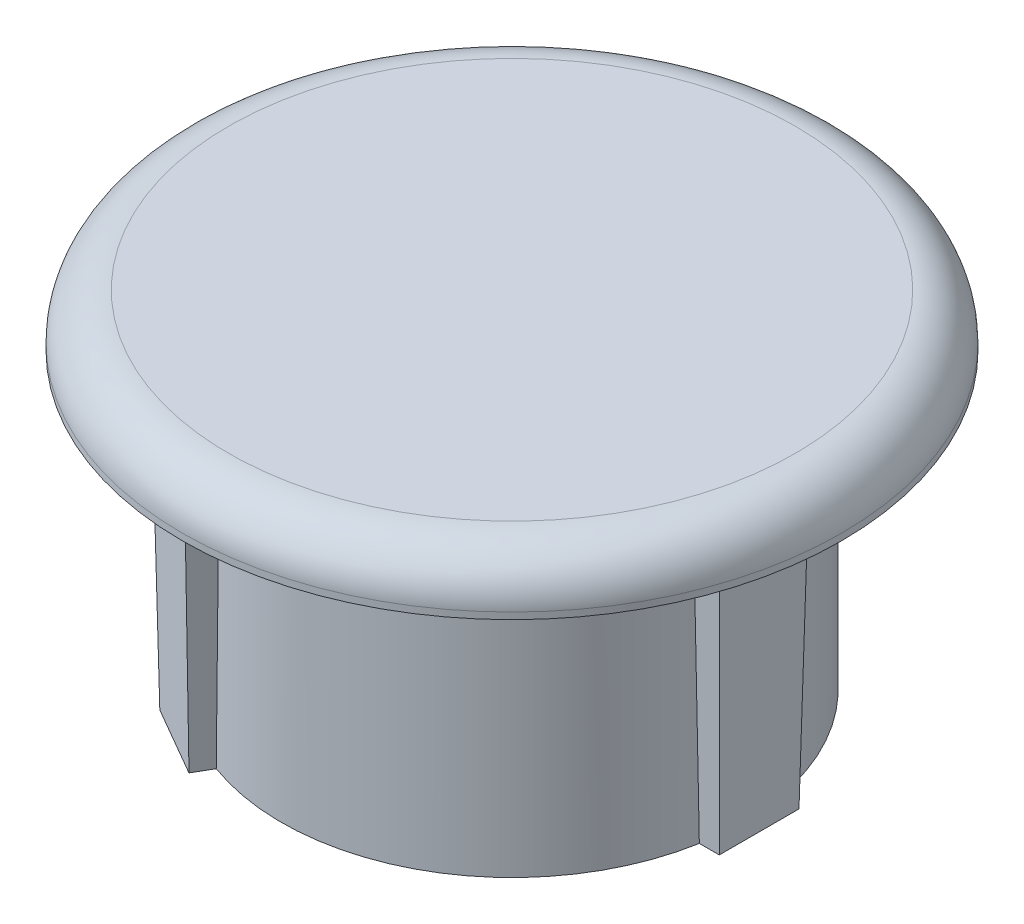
SolidWorks part; units mm, degrees
ref_plane "Face" through (0, 0, 0) normal (0, 0, 1) x (1, 0, 0)
ref_plane "Dessus" through (0, 0, 0) normal (0, 1, 0) x (1, 0, 0)
ref_plane "Droite" through (0, 0, 0) normal (1, 0, 0) x (0, 0, -1)
sketch "Esquisse1" plane through (0, 0, 0) normal (0, 0, 1) x (1, 0, 0)
  line L0 (0, 0) -> (0, 39.604) construction
  line L1 (2.3, 4) -> (0, 4)
  line L2 (2.3, 0) -> (3.5, 0)
  line L3 (2.3, 0) -> (2.3, 4)
  line L5 (3.5, 0) -> (3.5, 4.45)
  line L6 (0, 4) -> (0, 5.25)
  line L7 (0, 5.25) -> (4.3, 5.25)
  line L8 (5, 4.55) -> (5, 4.45)
  line L9 (5, 4.45) -> (3.5, 4.45)
  arc A0 (4.3, 5.25) -> (5, 4.55) centre (4.3, 4.55) cw
  point P13 (5, 5.25)
  dimension "D7" = 0.7
  dimension "D1" = 1.2
  dimension "D2" = 7
  dimension "D3" = 0.8
  dimension "D4" = 4
  dimension "D5" = 5.25
  dimension "D6" = 10
revolve "Révolution1" add sketch "Esquisse1" angle 360 about L0
sketch "Esquisse2" plane through (0, 0, 0) normal (0, -1, 0) x (1, 0, 0)
  line L0 (0, 0) -> (5.8892, 0) construction
  line L1 (3.4473, 0.6048) -> (3.75, 0.6048)
  line L2 (-1.1999, -3.2879) -> (-1.3512, -3.55)
  line L3 (3.4473, -0.6048) -> (3.75, -0.6048)
  line L4 (3.75, 0.6048) -> (3.75, -0.6048)
  line L5 (-2.2474, -2.6831) -> (-2.3988, -2.9452)
  line L6 (-1.3512, -3.55) -> (-2.3988, -2.9452)
  line L7 (-2.2474, 2.6831) -> (-2.3988, 2.9452)
  line L8 (-1.1999, 3.2879) -> (-1.3512, 3.55)
  line L9 (-2.3988, 2.9452) -> (-1.3512, 3.55)
  circle A0 centre (0, 0) radius 3.5 construction
  arc A1 (3.4473, -0.6048) -> (3.4473, 0.6048) centre (0, 0) ccw
  arc A2 (-2.2474, -2.6831) -> (-1.1999, -3.2879) centre (0, 0) ccw
  arc A3 (-1.1999, 3.2879) -> (-2.2474, 2.6831) centre (0, 0) ccw
  point P8 (3.75, 0)
  dimension "D1" = 7.25
extrude "Extrusion1" add sketch "Esquisse2" against normal up to surface (4.45 mm away) draft 1
